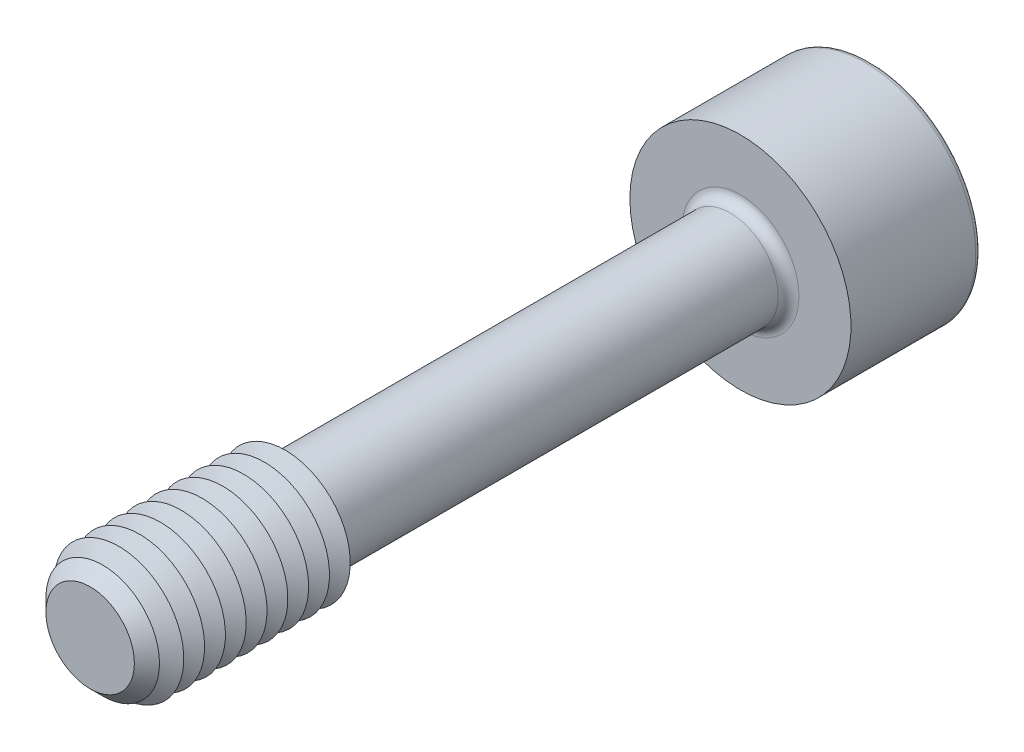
SolidWorks part; units mm, degrees
ref_plane "Front Plane" through (0, 0, 0) normal (0, 0, 1) x (1, 0, 0)
ref_plane "Top Plane" through (0, 0, 0) normal (0, 1, 0) x (1, 0, 0)
ref_plane "Right Plane" through (0, 0, 0) normal (1, 0, 0) x (0, 0, -1)
sketch "Sketch1" plane through (0, 0, 0) normal (0, 0, 1) x (1, 0, 0)
  circle A0 centre (0, 0) radius 1.85
  dimension "D1" = 3.7
extrude "Extrude1" add sketch "Sketch1" along normal mid plane 25
sketch "Sketch2" plane through (0, 0, 0) normal (1, 0, 0) x (0, 0, -1)
  line L0 (-12.5, 0) -> (-12.5, 2.5)
  line L1 (-12.5, 1.85) -> (-12.5, -1.85) construction
  line L2 (-12.5, 2.5) -> (-5, 2.5)
  line L3 (-5, 2.5) -> (-4.6247, 1.85)
  line L4 (12.5, 1.85) -> (-12.5, 1.85) construction
  line L5 (-4.6247, 1.85) -> (-4.6247, 0)
  line L6 (-4.6247, 0) -> (-12.5, 0)
  dimension "D1" = 2.5
  dimension "D2" = 120
  dimension "D3" = 7.5
revolve "Revolve1" add sketch "Sketch2" angle 360 about L6
chamfer "Chamfer1" distance 0.8 angle 45 1 edges at (0, 2.5, 12.5)
sketch "Sketch3" plane through (0, 0, -12.5) normal (0, 0, -1) x (-1, 0, 0)
  circle A0 centre (0, 0) radius 4.25
  dimension "D1" = 8.5
extrude "Extrude2" add sketch "Sketch3" along normal blind 5
sketch "Sketch4" plane through (-13.7, 0, -17.5) normal (0, 0, 1) x (1, 0, 0)
  line L2 (12.5453, -2) -> (14.8547, -2)
  line L3 (14.8547, -2) -> (16.0094, 0)
  line L4 (16.0094, 0) -> (14.8547, 2)
  line L6 (14.8547, 2) -> (12.5453, 2)
  line L7 (12.5453, 2) -> (11.3906, 0)
  line L8 (11.3906, 0) -> (12.5453, -2)
  circle A0 centre (13.7, 0) radius 2 construction
  dimension "D1" = 4
extrude "Extrude3" cut sketch "Sketch4" along normal blind 4
fillet "Fillet1" radius 0.4 1 edges at (-1.85, 0, -12.5)
fillet "Fillet2" radius 0.2 1 edges at (-4.25, 0, -17.5)
sketch "Sketch5" plane through (0, 0, 0) normal (1, 0, 0) x (0, 0, -1)
  line L0 (13.5, 0) -> (13.5, -2)
  line L1 (13.5, -2) -> (12.3453, 0)
  line L2 (12.3453, 0) -> (13.5, 0)
  dimension "D1" = 30
revolve "Cut-Revolve1" cut sketch "Sketch5" angle 360 about L2
sketch "Sketch6" plane through (0, 0, 0) normal (1, 0, 0) x (0, 0, -1)
  line L0 (1.332, 0) -> (-13.289, 0) construction
sketch "Sketch7" plane through (0, 0, 0) normal (1, 0, 0) x (0, 0, -1)
  line L0 (-5, 2.5) -> (-5.4, 1.8072)
  line L1 (-5.4, 1.8072) -> (-5.8, 2.5)
  line L2 (-5, 2.5) -> (-11.7, 2.5) construction
  line L3 (-5.8, 2.5) -> (-5, 2.5)
  dimension "D1" = 0.8
revolve "Cut-Revolve2" cut sketch "Sketch7" angle 360 about L0
pattern_linear "LPattern1" count 9 spacing 0.8 along (0, 0, 1) of "Cut-Revolve2"
